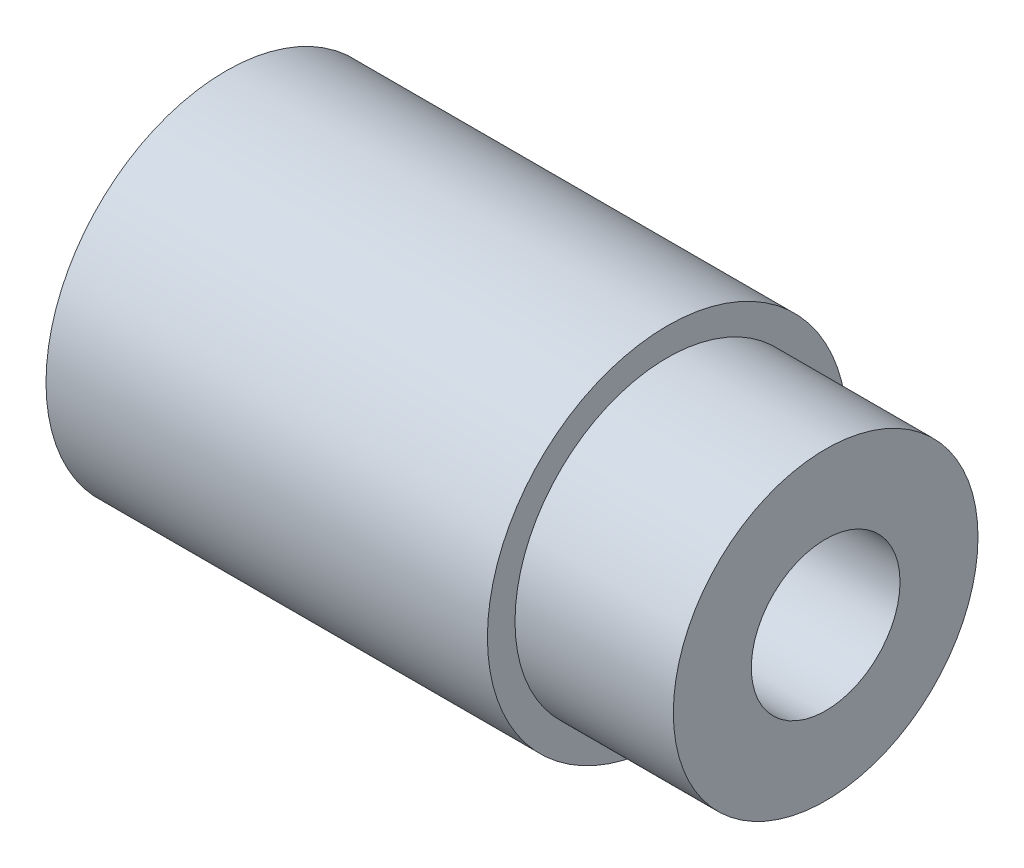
SolidWorks part; units mm, degrees
ref_plane "Plan de face" through (0, 0, 0) normal (0, 0, 1) x (1, 0, 0)
ref_plane "Plan de dessus" through (0, 0, 0) normal (0, 1, 0) x (1, 0, 0)
ref_plane "Plan de droite" through (0, 0, 0) normal (1, 0, 0) x (0, 0, -1)
sketch "Esquisse1" plane through (0, 0, 0) normal (1, 0, 0) x (0, 0, -1)
  circle A0 centre (0, 0) radius 7.5
  dimension "D1" = 15
extrude "L_Basculeurs" add sketch "Esquisse1" against normal blind 25
sketch "Esquisse2" plane through (0, 0, 0) normal (1, 0, 0) x (0, 0, -1)
  circle A0 centre (0, 0) radius 6.35
  dimension "D1" = 12.7
extrude "L_Corps-Amort" cut sketch "Esquisse2" against normal blind 6.6 flip side to cut
sketch "Esquisse3" plane through (0, 0, 0) normal (1, 0, 0) x (0, 0, -1)
  circle A0 centre (0, 0) radius 3.1
  dimension "D1" = 6.2
extrude "Passage_Vis" cut sketch "Esquisse3" against normal through all
